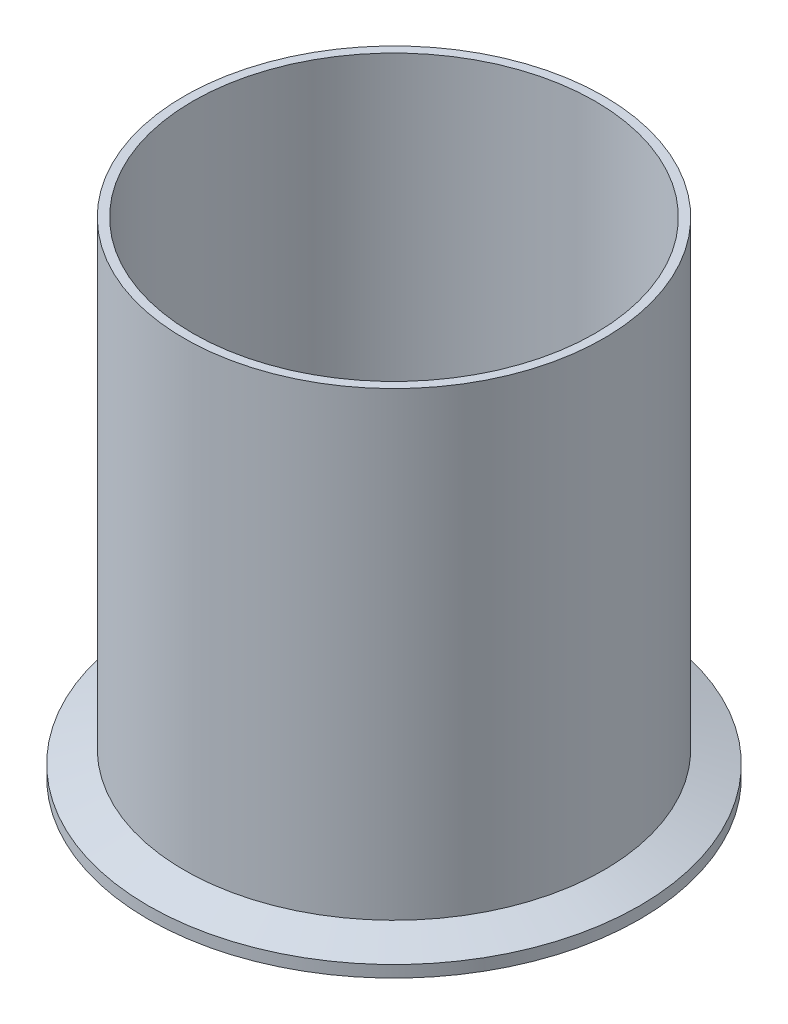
SolidWorks part; units mm, degrees
ref_plane "Front Plane" through (0, 0, 0) normal (0, 0, 1) x (1, 0, 0)
ref_plane "Top Plane" through (0, 0, 0) normal (0, 1, 0) x (1, 0, 0)
ref_plane "Right Plane" through (0, 0, 0) normal (1, 0, 0) x (0, 0, -1)
sketch "Sketch1" plane through (0, 0, 0) normal (0, 0, 1) x (1, 0, 0)
  line L0 (0, 0) -> (0, 117.475) construction
  line L1 (0, 117.475) -> (-50.8, 117.475)
  line L2 (-50.8, 117.475) -> (-50.8, 5.9973)
  line L3 (-50.8, 5.9973) -> (-59.4614, 2.8448)
  line L4 (-59.4614, 2.8448) -> (-59.4614, 0)
  line L5 (-59.4614, 0) -> (-56.6185, 0)
  line L6 (-52.9825, 0) -> (0, 0)
  line L7 (0, 0) -> (0, 117.475)
  line L8 (0, 117.475) -> (-48.6918, 117.475)
  line L9 (-48.6918, 117.475) -> (-48.6918, 0)
  line L10 (-48.6918, 0) -> (0, 0)
  line L11 (0, 0) -> (-0.1846, 0.0129)
  arc A0 (-55.896, 0.4745) -> (-53.705, 0.4745) centre (-54.8005, 0) cw
  arc A1 (-52.9825, 0) -> (-53.705, 0.4745) centre (-52.9825, 0.7874) cw
  arc A2 (-55.896, 0.4745) -> (-56.6185, 0) centre (-56.6185, 0.7874) cw
  point P12 (-53.6067, 0)
  dimension "D6" = 1.1938
  dimension "D7" = 0.7874
  dimension "D1" = 50.8
  dimension "D2" = 2.8448
  dimension "D3" = 59.4614
  dimension "D4" = 70
  dimension "D5" = 54.8005
  dimension "D8" = 2.1082
  dimension "D9" = 117.475
revolve "Revolve2" add sketch "Sketch1" angle 360 about L0
